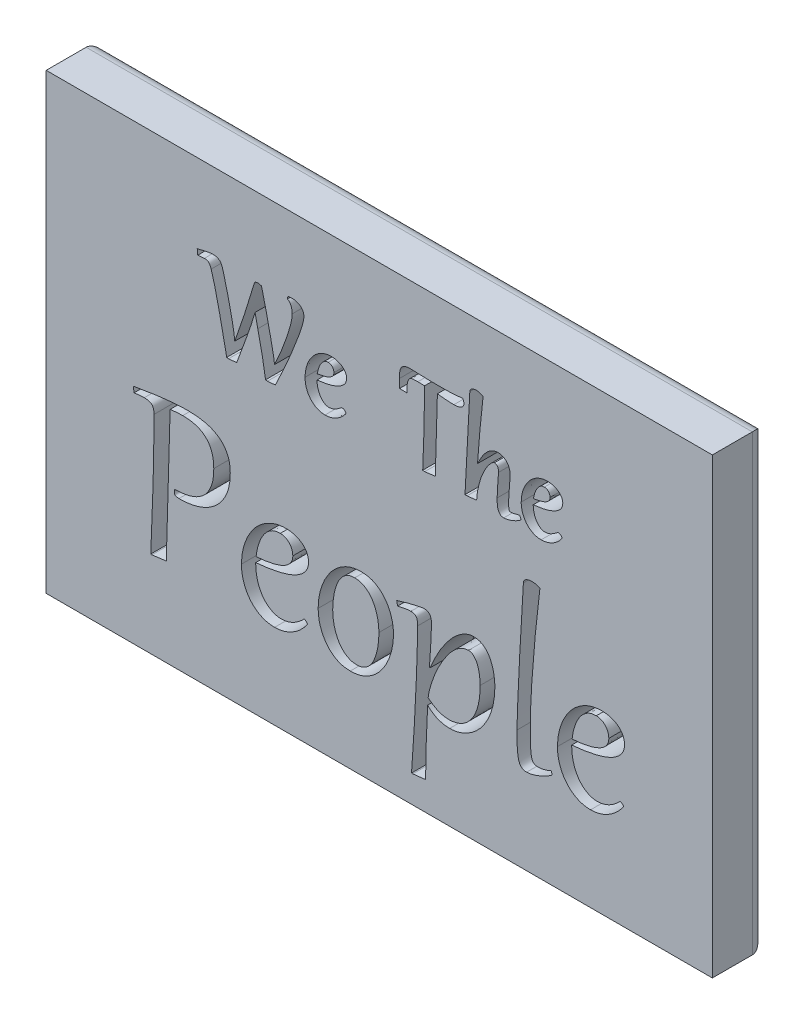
SolidWorks part; units mm, degrees
ref_plane "Front Plane" through (0, 0, 0) normal (0, 0, 1) x (1, 0, 0)
ref_plane "Top Plane" through (0, 0, 0) normal (0, 1, 0) x (1, 0, 0)
ref_plane "Right Plane" through (0, 0, 0) normal (1, 0, 0) x (0, 0, -1)
sketch "Sketch1" plane through (0, 0, 0) normal (0, 0, 1) x (1, 0, 0)
  line L1 (-15.875, -10.795) -> (15.875, -10.795)
  line L2 (-15.875, -10.795) -> (-15.875, 10.795)
  line L3 (-15.875, 10.795) -> (15.875, 10.795)
  line L4 (15.875, -10.795) -> (15.875, 10.795)
  line L5 (-15.875, -10.795) -> (15.875, 10.795) construction
  line L6 (-15.875, 10.795) -> (15.875, -10.795) construction
  point P0 (0, 0)
  dimension "D1" = 31.75
  dimension "D2" = 21.59
extrude "Boss-Extrude1" add sketch "Sketch1" along normal blind 2.54
fillet "Fillet1" radius 0.635 4 edges at (-15.875, 0, 0) (0, -10.795, 0) (0, 10.795, 0) (15.875, 0, 0)
sketch "Sketch2" plane through (0, 0, 2.54) normal (0, 0, 1) x (1, 0, 0)
  line L0 (-15.875, 10.795) -> (-14.977, 9.897) construction
  line L1 (-14.977, 9.897) -> (-14.977, 6.598) construction
  line L2 (-14.977, 6.598) -> (-14.977, 3.299) construction
  line L3 (-14.977, 3.299) -> (-14.977, 0) construction
  line L4 (-14.977, 0) -> (-14.977, -3.299) construction
  line L5 (-14.977, -3.299) -> (-14.977, -6.598) construction
  line L6 (-14.977, -6.598) -> (-14.977, -9.897) construction
  line L7 (-14.977, -9.897) -> (-15.875, -10.795) construction
  line L8 (15.875, 10.795) -> (-15.875, 10.795) construction
  line L9 (-15.875, -10.795) -> (15.875, -10.795) construction
  line L10 (-14.977, -9.897) -> (14.977, -9.897) construction
  line L11 (14.977, -9.897) -> (15.875, -10.795) construction
  line L12 (14.977, -9.897) -> (14.977, -6.598) construction
  line L13 (14.977, -6.598) -> (14.977, -3.299) construction
  line L14 (14.977, -3.299) -> (14.977, 0) construction
  line L15 (14.977, 0) -> (14.977, 3.299) construction
  line L16 (14.977, 3.299) -> (14.977, 6.598) construction
  line L17 (14.977, 6.598) -> (14.977, 9.897) construction
  line L18 (14.977, 9.897) -> (15.875, 10.795) construction
  line L19 (-14.977, 9.897) -> (14.977, 9.897) construction
  line L20 (-14.977, 6.598) -> (14.977, 6.598) construction
  line L21 (-14.977, 3.299) -> (14.977, 3.299) construction
  line L22 (-14.977, 0) -> (14.977, 0) construction
  line L23 (-14.977, -3.299) -> (14.977, -3.299) construction
  line L24 (-14.977, -6.598) -> (14.977, -6.598) construction
  text T0 "<b>We  The</b>" font "Gabriola" height in points 16
  text T1 "People" font "Gabriola" height in points 28
  dimension "D1" = 45
  dimension "D2" = 45
  dimension "D3" = 1.27
extrude "Cut-Extrude1" cut sketch "Sketch2" against normal blind 1.905
